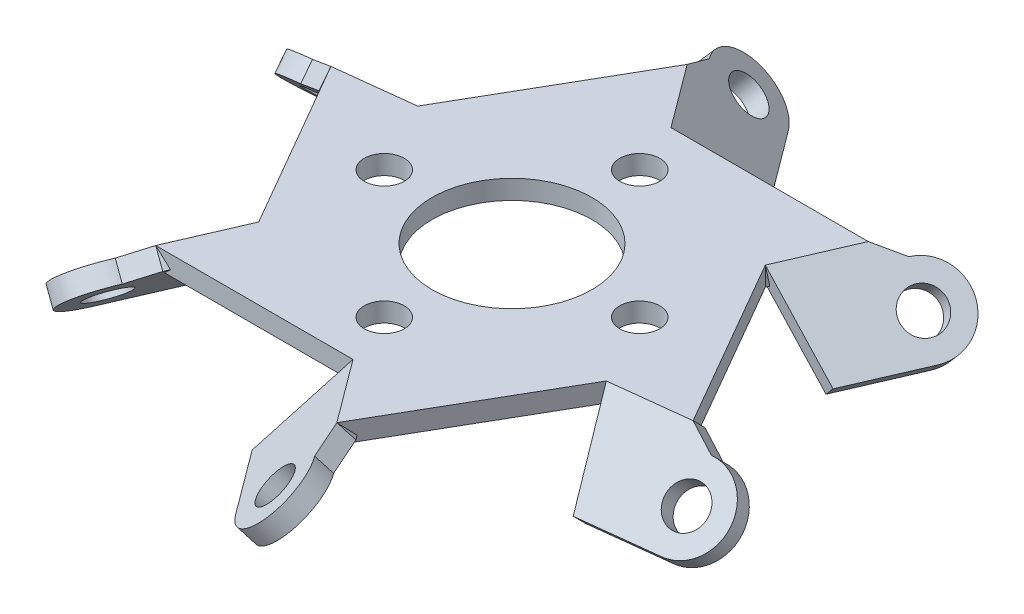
SolidWorks part; units mm, degrees
other "<MirrorMecanumHub - (Bottom).0003>-<<MecanumHub - (Bottom).0003>-<Imported1>>"
ref_plane "Front Plane" through (0, 0, 0) normal (0, 0, 1) x (1, 0, 0)
ref_plane "Top Plane" through (0, 0, 0) normal (0, 1, 0) x (1, 0, 0)
ref_plane "Right Plane" through (0, 0, 0) normal (1, 0, 0) x (0, 0, -1)
mirrored part "MirrorMecanumHub - (Bottom).0003_Mirrored"
